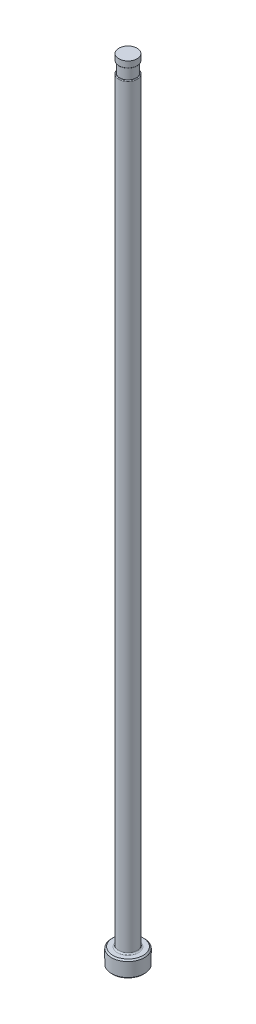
SolidWorks part; units mm, degrees
ref_plane "Front Plane" through (0, 0, 0) normal (0, 0, 1) x (1, 0, 0)
ref_plane "Top Plane" through (0, 0, 0) normal (0, 1, 0) x (1, 0, 0)
ref_plane "Right Plane" through (0, 0, 0) normal (1, 0, 0) x (0, 0, -1)
other "Configuration Table"
sketch "Sketch1" plane through (0, 0, 0) normal (0, 0, 1) x (1, 0, 0)
  line L0 (0, 259.9588) -> (0, -15.1925) construction
  line L1 (0, 0) -> (-3.175, 0)
  line L2 (-3.175, 0) -> (-3.175, 3.175)
  line L3 (-3.175, 3.175) -> (-1.7856, 3.175)
  line L4 (-1.7856, 3.175) -> (-1.7856, 152.4)
  line L5 (-1.7856, 152.4) -> (0, 152.4)
  line L6 (0, 152.4) -> (0, 0)
  dimension "L" = 152.4
  dimension "H" = 6.35
  dimension "T" = 3.175
  dimension "D" = 3.5712
revolve "Revolve1" add sketch "Sketch1" angle 360 about L0
chamfer "Chamfer1" distance 0.254 angle 45 2 edges at (0, 3.175, 3.175) (0, 0, 3.175)
fillet "Fillet1" radius 0.254 1 edges at (0, 3.175, 1.7856)
sketch "Sketch2" plane through (0, 0, 0) normal (0, 0, 1) x (1, 0, 0)
  line L0 (-1.7856, 152.4) -> (-1.7856, 3.429) construction
  line L1 (-1.7856, 151.13) -> (-1.5824, 151.13)
  line L2 (-1.7856, 151.13) -> (-1.7856, 149.098)
  line L3 (-1.7856, 149.098) -> (-1.5824, 149.098)
  line L4 (-1.5824, 151.13) -> (-1.5824, 149.098)
  line L5 (1.7856, 152.4) -> (-1.7856, 152.4) construction
  line L6 (0, 153.4483) -> (0, 147.3282) construction
  dimension "D1" = 2.032
  dimension "N" = 1.27
  dimension "FD" = 0.2032
  dimension "D3" = 3.1648
revolve "Vent Relief" cut sketch "Sketch2" angle 360 about L6
sketch "Sketch3" plane through (0, 0, 0) normal (0, 0, 1) x (1, 0, 0)
  line L0 (-1.5824, 150.114) -> (-1.5824, 86.614)
  line L1 (-1.5824, 151.13) -> (-1.5824, 149.098) construction
  line L2 (-1.7856, 149.098) -> (-1.7856, 3.429) construction
  line L3 (-1.7856, 85.4964) -> (-1.7856, 150.114)
  line L4 (-1.7856, 150.114) -> (-1.5824, 150.114)
  arc A0 (-1.5824, 86.614) -> (-1.7856, 85.4964) centre (-4.7574, 86.614) cw
  dimension "D1" = 3.175
  dimension "D2" = 63.5
extrude "D-Slot" cut sketch "Sketch3" against normal through all both and the other way through all
sketch "Sketch5" plane through (0, 0, 0) normal (0, 0, 1) x (1, 0, 0)
  line L0 (-1.7856, 151.13) -> (1.7856, 151.13) construction
  line L1 (-1.7856, 152.4) -> (-1.7666, 152.4)
  line L2 (-1.7856, 152.4) -> (-1.7856, 151.13)
  line L3 (-1.7856, 151.13) -> (-1.7666, 151.13)
  line L4 (-1.7666, 152.4) -> (-1.7666, 151.13)
  line L5 (0, 152.6877) -> (0, 150.5771) construction
  dimension "VP" = 0.019
revolve "Vent Diameter" cut sketch "Sketch5" angle 360 about L5
fillet "Fillet2" radius 0.127 2 edges at (1.7856, 149.098, 0) (0, 151.13, 1.7666)
sketch "Pocket Sketch" plane through (0, 0, 0) normal (0, 0, 1) x (1, 0, 0)
  line L0 (-3.5719, 0) -> (-3.5719, 3.2004)
  line L1 (-3.5719, 3.2004) -> (-2.7461, 3.2004)
  line L2 (-1.9841, 3.9624) -> (-1.9841, 22.225)
  line L3 (-1.9841, 22.225) -> (0, 22.225)
  line L4 (0, 22.225) -> (0, 0)
  line L5 (0, 0) -> (-3.5719, 0)
  line L6 (0, 12.6104) -> (0, -2.4989) construction
  line L7 (-3.175, 2.921) -> (-3.175, 0.254) construction
  line L8 (2.921, 3.175) -> (-2.921, 3.175) construction
  line L9 (-1.7856, 85.4964) -> (-1.7856, 3.429) construction
  line L10 (-2.7461, 3.2004) -> (-1.9841, 3.9624)
  point P3 (-1.9841, 3.2004)
  dimension "D1" = 7.1437
  dimension "D2" = 0.3969
  dimension "D3" = 0.0254
  dimension "D4" = 0.1984
  dimension "D5" = 3.9681
  dimension "D6" = 22.225
